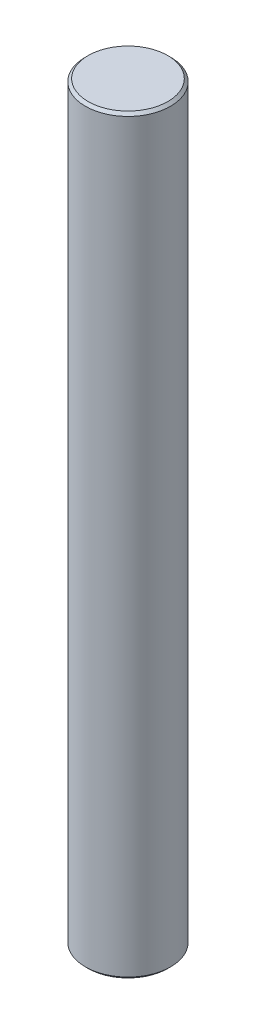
SolidWorks part; units mm, degrees
ref_plane "Front/Back" through (0, 0, 0) normal (0, 0, 1) x (1, 0, 0)
ref_plane "Top/Bottom" through (0, 0, 0) normal (0, 1, 0) x (1, 0, 0)
ref_plane "Right/Left" through (0, 0, 0) normal (1, 0, 0) x (0, 0, -1)
sketch "Sketch1" plane through (0, 0, 0) normal (0, 1, 0) x (1, 0, 0)
  circle A0 centre (0, 0) radius 3.9624
  dimension "D1" = 7.9248
extrude "Extrude1" add sketch "Sketch1" along normal mid plane 69.85
chamfer "Chamfer1" distance 0.254 angle 45 2 edges at (0, -34.925, 3.9624) (0, 34.925, 3.9624)
